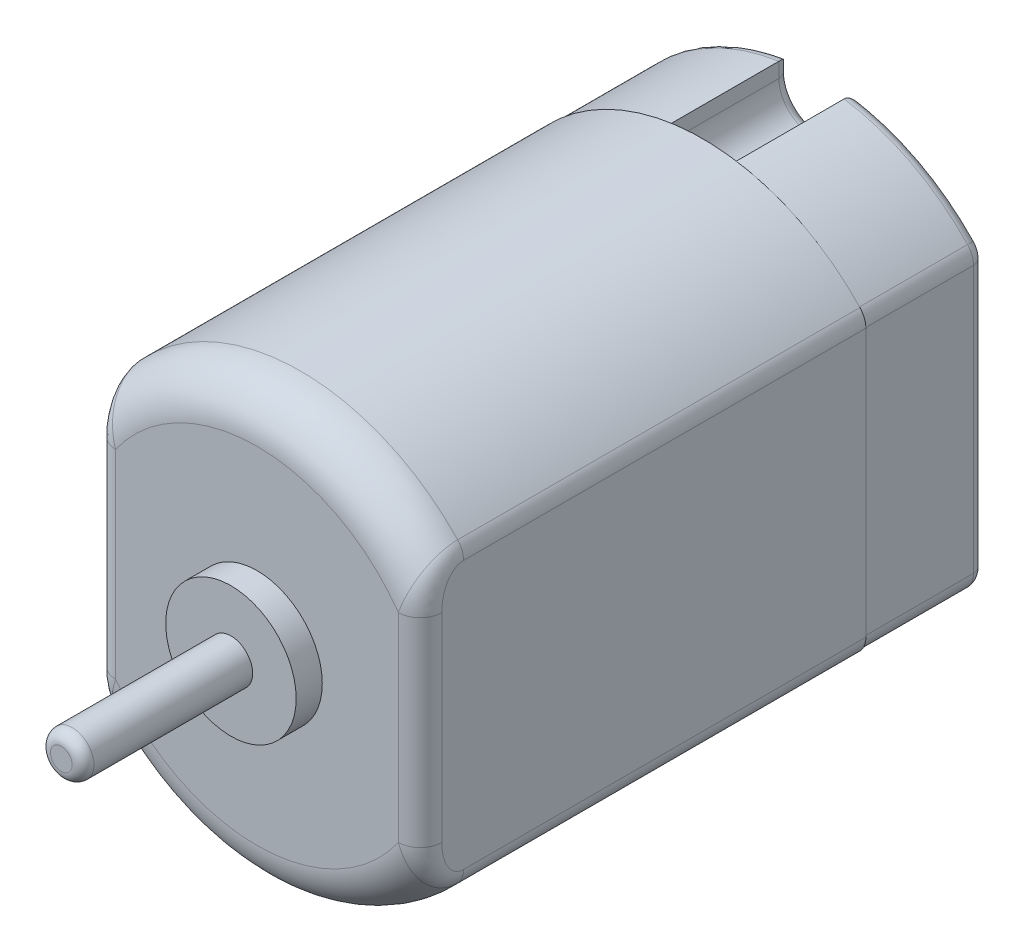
SolidWorks part; units mm, degrees
ref_plane "Plan de face" through (0, 0, 0) normal (0, 0, 1) x (1, 0, 0)
ref_plane "Plan de dessus" through (0, 0, 0) normal (0, 1, 0) x (1, 0, 0)
ref_plane "Plan de droite" through (0, 0, 0) normal (1, 0, 0) x (0, 0, -1)
sketch "Esquisse1" plane through (0, 0, 0) normal (0, 0, 1) x (1, 0, 0)
  circle A0 centre (0, 0) radius 9.95
extrude "Boss.-Extru.1" add sketch "Esquisse1" along normal blind 20.5
fillet "Congé1" radius 2 1 edges at (9.95, 0, 20.5)
sketch "Esquisse2" plane through (0, 0, 20.5) normal (0, 0, 1) x (1, 0, 0)
  line L0 (0, 10.8897) -> (0, -3.8573) construction
  line L1 (7.5, 13.7604) -> (7.5, -12.2805) construction
  line L2 (-7.5, 13.7604) -> (-7.5, -12.2805) construction
  line L4 (7.5, 7.1479) -> (10.2337, 7.1479)
  line L5 (7.5, 7.1479) -> (7.5, -7.8091)
  line L6 (7.5, -7.8091) -> (10.2337, -7.8091)
  line L7 (10.2337, 7.1479) -> (10.2337, -7.8091)
  line L8 (-7.5, 8.3444) -> (-10.5801, 8.3444)
  line L9 (-7.5, 8.3444) -> (-7.5, -7.8091)
  line L10 (-7.5, -7.8091) -> (-10.5801, -7.8091)
  line L11 (-10.5801, 8.3444) -> (-10.5801, -7.8091)
  dimension "D1" = 7.5
  dimension "D2" = 15
extrude "Enlèv. mat.-Extru.1" cut sketch "Esquisse2" against normal blind 20.5
fillet "Congé2" radius 1 10 edges at (-7.5, -6.5385, 9.25) (-7.5, 6.5385, 9.25) (-7.5, -6.1067, 19.5177) (-7.5, 5.9816, 19.6401) (-7.5, 0, 20.5) (7.5, 6.5385, 9.25) (7.5, -6.5385, 9.25) (7.5, 6.294, 19.2815) (7.5, -5.9985, 19.6248) (7.5, 0, 20.5)
sketch "Esquisse3" plane through (0, 0, 20.5) normal (0, 0, 1) x (1, 0, 0)
  circle A0 centre (0, 0) radius 3
extrude "Boss.-Extru.2" add sketch "Esquisse3" along normal blind 1.2
sketch "Esquisse4" plane through (0, 0, 21.7) normal (0, 0, 1) x (1, 0, 0)
  circle A0 centre (0, 0) radius 1
extrude "Boss.-Extru.3" add sketch "Esquisse4" along normal blind 7.8
sketch "Esquisse5" plane through (0, 0, 0) normal (0, 0, -1) x (-1, 0, 0)
  line L0 (7.5, -9.1316) -> (7.5, 9.6827) construction
  line L1 (0, 4.0148) -> (0, -11.0938) construction
  line L2 (7.45, 6.1325) -> (7.45, -6.1325)
  line L3 (-7.45, 6.1325) -> (-7.45, -6.1325)
  line L4 (4.5832, 0) -> (-3.1691, 0) construction
  line L5 (4.2914, -9.9) -> (-1.4251, -9.9) construction
  line L6 (4.2914, -7.6) -> (-0.8514, -7.6) construction
  line L7 (1.5, -9.1) -> (1.5, -9.7857)
  line L8 (-1.5, -9.1) -> (-1.5, -9.7857)
  line L9 (-1.5, 9.1) -> (-1.5, 9.7857)
  line L10 (1.5, 9.1) -> (1.5, 9.7857)
  arc A0 (7.1747, 6.8215) -> (1.5, 9.7857) centre (0, 0) ccw
  arc A1 (-7.1747, -6.8215) -> (-1.5, -9.7857) centre (0, 0) ccw
  arc A2 (-7.45, 6.1325) -> (-7.1747, 6.8215) centre (-6.45, 6.1325) cw
  arc A3 (7.45, 6.1325) -> (7.1747, 6.8215) centre (6.45, 6.1325) ccw
  arc A4 (7.45, -6.1325) -> (7.1747, -6.8215) centre (6.45, -6.1325) cw
  arc A5 (-7.1747, -6.8215) -> (-7.45, -6.1325) centre (-6.45, -6.1325) cw
  arc A6 (1.5, 9.1) -> (-1.5, 9.1) centre (0, 9.1) cw
  arc A7 (-1.5, 9.7857) -> (-7.1747, 6.8215) centre (0, 0) ccw
  arc A8 (1.5, -9.1) -> (-1.5, -9.1) centre (0, -9.1) ccw
  arc A9 (1.5, -9.7857) -> (7.1747, -6.8215) centre (0, 0) ccw
  dimension "D1" = 0.1
  dimension "D2" = 1
  dimension "D3" = 2.3
extrude "Boss.-Extru.4" add sketch "Esquisse5" along normal blind 5.5
sketch "Esquisse6" plane through (0, 0, -5.5) normal (0, 0, -1) x (-1, 0, 0)
  line L0 (0, 2.4756) -> (0, -6.3224) construction
  line L1 (4, 6.3327) -> (4, -7.0283) construction
  line L2 (4, 2.8302) -> (4, -2.8302)
  arc A0 (4, 2.8302) -> (4, -2.8302) centre (0, 0) ccw
  dimension "D1" = 4
extrude "Boss.-Extru.5" add sketch "Esquisse6" along normal blind 2
sketch "Esquisse7" plane through (0, 0, -7.5) normal (0, 0, -1) x (-1, 0, 0)
  circle A0 centre (0, 0) radius 1
extrude "Boss.-Extru.6" add sketch "Esquisse7" along normal blind 1.5
fillet "Congé4" radius 0.5 18 edges at (-1.5, 9.4429, -5.5) (1.5, 9.4429, -5.5) (-4.5836, 8.775, -5.5) (-7.3786, 6.5035, -5.5) (-7.45, 0, -5.5) (-7.3786, -6.5035, -5.5) (1.5, -9.4429, -5.5) (-1.5, -9.4429, -5.5) (4.5836, 8.775, -5.5) (7.3786, 6.5035, -5.5) (7.45, 0, -5.5) (7.3786, -6.5035, -5.5) (0, 7.6, -5.5) (-4.5836, -8.775, -5.5) (0, -7.6, -5.5) (4.5836, -8.775, -5.5) (-4, 0, -7.5) (4.9, 0, -7.5)
fillet "Congé3" radius 0.5 2 edges at (1, 0, 29.5) (-1, 0, -9)
